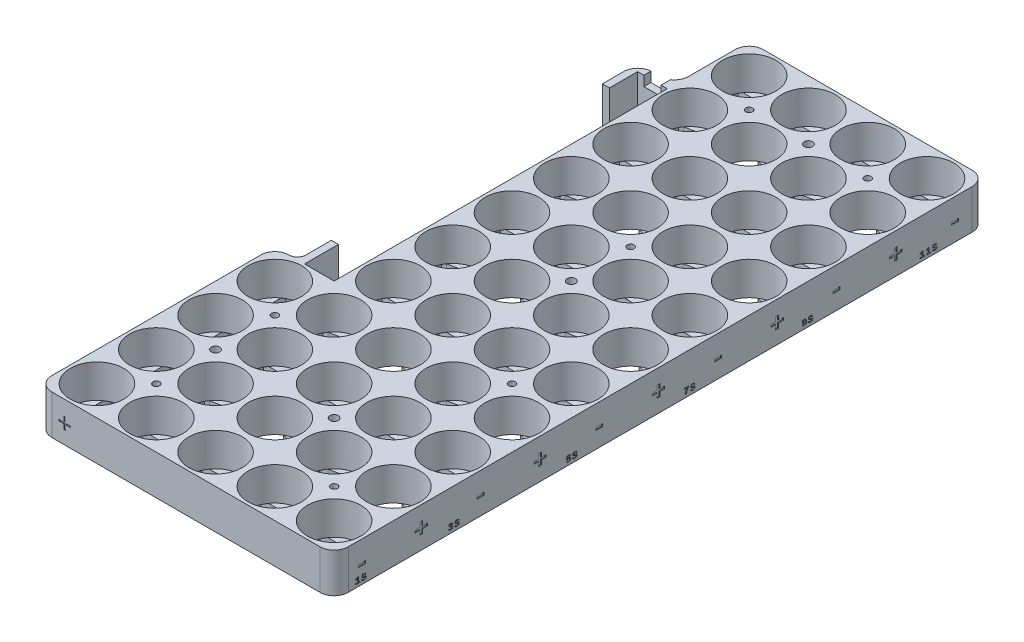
SolidWorks part; units mm, degrees
ref_plane "Plan de face" through (0, 0, 0) normal (0, 0, 1) x (1, 0, 0)
ref_plane "Plan de dessus" through (0, 0, 0) normal (0, 1, 0) x (1, 0, 0)
ref_plane "Plan de droite" through (0, 0, 0) normal (1, 0, 0) x (0, 0, -1)
ref_plane "Plan1" [suppressed] through (0, -1, 0) normal (0, 1, 0) x (1, 0, 0)
sketch "Esquisse1" plane through (0, 0, 0) normal (0, 1, 0) x (1, 0, 0)
  line L0 (-63, 0) -> (63, 0) construction
  line L1 (63, 0) -> (63, 84) construction
  line L2 (63, 84) -> (42, 84) construction
  line L3 (42, 84) -> (42, 231)
  line L4 (42, 231) -> (-42, 231)
  line L5 (-42, 231) -> (-42, 84)
  line L6 (-42, 84) -> (-63, 84)
  line L7 (-63, 84) -> (-63, 0)
  line L8 (42, 84) -> (42, 0)
  line L9 (42, 0) -> (-63, 0)
extrude "Boss.-Extru.1" add sketch "Esquisse1" along normal blind 14
sketch "Esquisse2" plane through (0, 14, 0) normal (0, 1, 0) x (1, 0, 0)
  line L0 (-63, 84) -> (-63, 0) construction
  line L2 (-63, 0) -> (42, 0) construction
  circle A0 centre (-52.5, 10.5) radius 9.475
extrude "Enlèv. mat.-Extru.1" cut sketch "Esquisse2" against normal offset from surface (11.8 mm away) 2.2
pattern_linear "Répétition linéaire1" count 11 spacing 21 along (0, 0, -1) count 6 spacing 21 along (1, 0, 0) of "Enlèv. mat.-Extru.1"
sketch "Esquisse3" plane through (0, 14, 0) normal (0, 1, 0) x (1, 0, 0)
  line L2 (-52.5, 52.5) -> (-31.5, 31.5) construction
  circle A0 centre (-42, 42) radius 1.5
  circle A1 centre (-52.5, 52.5) radius 9.475 construction
  circle A3 centre (-31.5, 31.5) radius 9.475 construction
  dimension "D1" = 3
extrude "Enlèv. mat.-Extru.2" cut sketch "Esquisse3" against normal through all
chamfer "Chanfrein1" distance 2.6 angle 45 1 edges at (-42, 0, -40.5)
pattern_linear "Répétition linéaire2" count 2 spacing 42 along (1, 0, 0) of "Enlèv. mat.-Extru.2", "Chanfrein1"
pattern_linear "Répétition linéaire3" count 3 spacing 84 along (0, 0, -1) of "Répétition linéaire2"
sketch "Esquisse6" plane through (0, 0, 0) normal (0, -1, 0) x (1, 0, 0)
  line L0 (-41, -5) -> (-41, -16)
  line L1 (-41, -5) -> (41, -5)
  line L2 (-41, -16) -> (41, -16)
  line L3 (41, -5) -> (41, -16)
  line L4 (42, 0) -> (42, -231) construction
  line L5 (0, 0) -> (0, -5) construction
  line L6 (-63, 0) -> (42, 0) construction
  point P9 (-41, -10.5)
extrude "Enlèv. mat.-Extru.5" cut sketch "Esquisse6" against normal up to surface (2.2 mm away) contours L1 L3 L2 L0
pattern_linear "Répétition linéaire6" count 11 spacing 21 along (0, 0, -1) of "Enlèv. mat.-Extru.5"
sketch "Esquisse7" plane through (0, 0, 0) normal (0, -1, 0) x (1, 0, 0)
  line L0 (-58, -1) -> (-58, -83)
  line L1 (-58, -1) -> (-47, -1)
  line L2 (-58, -83) -> (-47, -83)
  line L3 (-47, -1) -> (-47, -83)
  line L4 (-41, -16) -> (41, -16) construction
  line L5 (-41, -5) -> (-41, -16) construction
  line L6 (-63, -84) -> (-63, 0) construction
  line L7 (-42, -84) -> (-63, -84) construction
  point P8 (-52.5, -83)
extrude "Enlèv. mat.-Extru.6" cut sketch "Esquisse7" against normal up to surface (2.2 mm away)
fillet "Congé1" radius 5 5 edges at (42, 7, -231) (-42, 7, -231) (-63, 7, -84) (-63, 7, 0) (42, 7, 0)
sketch "Esquisse8" plane through (0, 0, 0) normal (0, -1, 0) x (1, 0, 0)
  line L0 (-39.2153, -205) -> (-26.5, -207.5483)
  line L1 (-26.5, -207.5483) -> (-26.5, -212.4517)
  line L2 (-26.5, -212.4517) -> (-39.2153, -215)
  line L3 (-39.2153, -215) -> (-2.7847, -215)
  line L4 (-2.7847, -215) -> (-15.5, -212.4517)
  line L5 (-15.5, -212.4517) -> (-15.5, -207.5483)
  line L6 (-15.5, -207.5483) -> (-2.7847, -205)
  line L7 (-2.7847, -205) -> (-39.2153, -205)
  line L8 (-26.5, -210) -> (-15.5, -210) construction
  line L9 (-41, -194) -> (-41, -205) construction
  arc A1 (-23.7847, -226) -> (-23.7847, -215) centre (-31.5, -220.5) ccw construction
  arc A2 (-18.2153, -215) -> (-18.2153, -226) centre (-10.5, -220.5) ccw construction
  arc A4 (-23.7847, -205) -> (-23.7847, -194) centre (-31.5, -199.5) ccw construction
extrude "Enlèv. mat.-Extru.7" cut sketch "Esquisse8" against normal up to surface (2.2 mm away)
pattern_linear "Répétition linéaire7" count 5 spacing 42 along (0, 0, 1) count 2 spacing 42 along (1, 0, 0) of "Enlèv. mat.-Extru.7"
sketch "Esquisse9" plane through (0, 0, 0) normal (0, -1, 0) x (1, 0, 0)
  line L0 (-41, -5) -> (-41, -16)
  line L1 (-41, -5) -> (-44.7847, -5)
  line L2 (-41, -16) -> (-44.7847, -16)
  line L4 (-47, -23.7847) -> (-47, -18.2153) construction
  line L5 (-47, -83) -> (-47, -1) construction
  line L6 (-47, -2.7847) -> (-47, -18.2153)
  arc A0 (-47, -2.7847) -> (-44.7847, -5) centre (-52.5, -10.5) cw
  arc A1 (-47, -2.7847) -> (-58, -2.7847) centre (-52.5, -10.5) ccw construction
  arc A2 (-44.7847, -16) -> (-47, -18.2153) centre (-52.5, -10.5) cw
extrude "Enlèv. mat.-Extru.8" cut sketch "Esquisse9" against normal up to surface (2.2 mm away)
sketch "Esquisse10" [suppressed] plane through (0, 15, 0) normal (0, 1, 0) x (1, 0, 0)
  line L0 (42, 17.025) -> (42, 231)
  line L1 (42, 5) -> (42, 226) construction
  line L2 (42, 231) -> (-63, 231)
  line L3 (-63, 231) -> (-63, 0)
  line L4 (-63, 0) -> (3.975, 0)
  line L5 (-58, 0) -> (37, 0) construction
  line L6 (-1.025, 5) -> (-1.025, 17.025)
  line L7 (3.975, 22.025) -> (37, 22.025)
  line L9 (-63, 79) -> (-63, 5) construction
  line L10 (37, 231) -> (-37, 231) construction
  arc A0 (3.975, 0) -> (-1.025, 5) centre (3.975, 5) cw
  arc A1 (-1.025, 17.025) -> (3.975, 22.025) centre (3.975, 17.025) cw
  arc A2 (37, 22.025) -> (42, 17.025) centre (37, 17.025) cw
  arc A4 (37, 0) -> (42, 5) centre (37, 5) ccw construction
  arc A5 (3.1668, 25.5) -> (17.8332, 25.5) centre (10.5, 31.5) ccw construction
  circle A6 centre (-10.5, 10.5) radius 9.475 construction
  point P25 (-1.025, 10.5)
  point P31 (10.5, 22.025)
extrude "Enlèv. mat.-Extru.9" [suppressed] cut sketch "Esquisse10" against normal through all
sketch "Esquisse11" plane through (42, 0, 0) normal (1, 0, 0) x (0, 0, -1)
  line L0 (7.2951, 4.2041) -> (226, 4.2041) construction
  line L6 (226, 0) -> (226, 14) construction
  text T0 "- + - + - + - + - + -" font "Liberation Mono" height 5.26
extrude "TEXTE A" cut sketch "Esquisse11" against normal blind 0.35
sketch "Esquisse12" plane through (0, 0, 0) normal (0, 0, 1) x (1, 0, 0)
  line L0 (-58, 3.665) -> (-48.784, 3.665) construction
  line L1 (-58, 14) -> (-58, 0) construction
  text T0 "+" font "Century Gothic" height in points 23
extrude "TEXTE A x4" cut sketch "Esquisse12" against normal blind 0.2
sketch "Esquisse13" plane through (42, 0, 0) normal (1, 0, 0) x (0, 0, -1)
  line L0 (7.4084, 1.0445) -> (226, 1.0445) construction
  line L1 (226, 0) -> (226, 14) construction
  text T0 "1S             3S                 5S                 7S                 9S                 11S" font "Liberation Mono" height 2
extrude "Enlèv. mat.-Extru.10" cut sketch "Esquisse13" against normal blind 0.35
sketch "Esquisse14" [suppressed] plane through (0, 0, 0) normal (0, -1, 0) x (1, 0, 0)
  line L0 (0, -231) -> (0, -189)
  line L2 (0, -189) -> (42, -189)
  line L3 (42, -5) -> (42, -226) construction
  line L4 (42, -189) -> (42, 33.4331)
  line L5 (42, 33.4331) -> (-152.2459, 33.4331)
  line L6 (-152.2459, 33.4331) -> (-152.2459, -231)
  line L7 (-152.2459, -231) -> (0, -231)
  line L8 (37, -231) -> (-37, -231) construction
  line L9 (21, -184) -> (21, -194) construction
  line L10 (18.2153, -184) -> (23.7847, -184) construction
  line L11 (18.2153, -194) -> (23.7847, -194) construction
  point P2 (21, -189)
extrude "Enlèv. mat.-Extru.11" [suppressed] cut sketch "Esquisse14" against normal through all
fillet "Congé2" [suppressed] radius 6
sketch "Esquisse15" [suppressed] plane through (0, 0, 0) normal (0, -1, 0) x (1, 0, 0)
  line L0 (0, -205.9) -> (0, -214.1)
  arc A0 (0, -214.1) -> (0, -205.9) centre (0, -210) ccw construction
  arc A1 (0, -214.1) -> (0, -205.9) centre (0, -210) ccw
extrude "Boss.-Extru.2" [suppressed] add sketch "Esquisse15" against normal up to surface (12 mm away)
sketch "Esquisse16" plane through (0, 0, 0) normal (0, -1, 0) x (1, 0, 0)
  line L0 (21, -26) -> (21, -16) construction
  line L1 (18.2153, -26) -> (23.7847, -26) construction
  line L2 (18.2153, -16) -> (23.7847, -16) construction
  line L3 (-52.5, -52.5) -> (-31.5, -73.5) construction
  line L4 (-42, -21) -> (-42, -63) construction
  line L5 (0, -142) -> (0, -152) construction
  line L6 (21, -21) -> (-42, -21) construction
  line L7 (-2.7847, -142) -> (2.7847, -142) construction
  line L8 (-2.7847, -152) -> (2.7847, -152) construction
  line L9 (-21, -210) -> (21, -210) construction
  line L10 (-10.5, -199.5) -> (-31.5, -220.5) construction
  line L11 (10.5, -73.5) -> (31.5, -94.5) construction
  circle A0 centre (-42, -21) radius 1.2
  circle A1 centre (-42, -63) radius 1.2
  circle A2 centre (21, -21) radius 1.2
  circle A3 centre (0, -147) radius 1.2
  circle A4 centre (-21, -210) radius 1.2
  circle A5 centre (21, -210) radius 1.2
  circle A6 centre (21, -84) radius 1.2
  circle A8 centre (0, -210) radius 1.5 construction
  point P30 (0, -210)
  dimension "D1" = 2.4
extrude "Enlèv. mat.-Extru.12" cut sketch "Esquisse16" against normal through all
chamfer "Chanfrein2" [suppressed] distance 3 angle 45
sketch "Esquisse17" plane through (0, 0, 0) normal (0, -1, 0) x (1, 0, 0)
  line L1 (-42, -84) -> (-55, -84)
  line L2 (-42, -84) -> (-42, -96)
  line L3 (-42, -96) -> (-55, -96)
  line L4 (-55, -84) -> (-55, -96)
  dimension "D1" = 13
  dimension "D2" = 12
extrude "Boss.-Extru.3" add sketch "Esquisse17" against normal up to surface (14 mm away)
sketch "Esquisse19" plane through (0, 0, -96) normal (0, 0, -1) x (-1, 0, 0)
  line L0 (39.2153, 2.2) -> (23.7847, 2.2) construction
  line L1 (42, 14) -> (52.5, 14)
  line L2 (42, 14) -> (42, 1.4)
  line L3 (42, 1.4) -> (52.5, 1.4)
  line L4 (52.5, 14) -> (52.5, 1.4)
  line L5 (39.2153, 2.2) -> (23.7847, 2.2) construction
  dimension "D1" = 10.5
  dimension "D2" = 0.8
extrude "Enlèv. mat.-Extru.13" cut sketch "Esquisse19" against normal up to surface (12 mm away)
fillet "Congé3" radius 3 1 edges at (-55, 7, -84)
sketch "Esquisse20" plane through (0, 14, 0) normal (0, 1, 0) x (1, 0, 0)
  line L0 (-42, 226) -> (-42, 84) construction
  line L1 (-42, 204.5) -> (-55, 204.5)
  line L2 (-42, 204.5) -> (-42, 202)
  line L3 (-52.5, 192) -> (-55, 192)
  line L4 (-55, 204.5) -> (-55, 192)
  line L6 (-42, 202) -> (-55, 202) construction
  line L7 (-48.5, 202) -> (-48.5, 204.5) construction
  line L8 (-55, 96) -> (-52.5, 96) construction
  line L9 (-52.5, 84) -> (-42, 84) construction
  line L10 (-55, 87) -> (-55, 96) construction
  line L11 (-52.5, 192) -> (-52.5, 202)
  line L12 (-52.5, 202) -> (-42, 202)
  line L13 (-52.5, 84) -> (-52.5, 96) construction
  dimension "D1" = 118
  dimension "D2" = 10
extrude "Boss.-Extru.4" add sketch "Esquisse20" against normal up to surface (14 mm away)
sketch "Esquisse21" plane through (0, 0, 0) normal (0, -1, 0) x (1, 0, 0)
  line L1 (-42, -202) -> (-52.5, -202)
  line L2 (-42, -202) -> (-42, -192)
  line L3 (-42, -192) -> (-52.5, -192)
  line L4 (-52.5, -202) -> (-52.5, -192)
extrude "Boss.-Extru.5" add sketch "Esquisse21" against normal up to surface (1.4 mm away)
fillet "Congé4" radius 5 2 edges at (-42, 7, -204.5) (-55, 7, -204.5)
sketch "Esquisse22" plane through (0, 0, -202) normal (0, 0, 1) x (1, 0, 0)
  line L0 (-52.5, 14) -> (-42, 14) construction
  line L1 (-50.3, 14) -> (-44.2, 14)
  line L2 (-50.3, 14) -> (-50.3, 10.5)
  line L3 (-50.3, 10.5) -> (-44.2, 10.5)
  line L4 (-44.2, 14) -> (-44.2, 10.5)
  line L5 (-42, 1.4) -> (-42, 14) construction
  dimension "D1" = 2.2
  dimension "D2" = 2.2
  dimension "D3" = 3.5
extrude "Enlèv. mat.-Extru.14" cut sketch "Esquisse22" against normal blind 10
sketch "Esquisse23" [suppressed] plane through (0, 0, 0) normal (0, -1, 0) x (1, 0, 0)
  line L0 (-42, -192) -> (-42, -96) construction
  line L1 (-110.4959, 30.5264) -> (75.944, 30.5264)
  line L2 (-110.4959, 30.5264) -> (-110.4959, -142)
  line L3 (-42, -142) -> (42, -142)
  line L4 (75.944, 30.5264) -> (75.944, -142)
  line L5 (-41, -142) -> (41, -142) construction
  line L6 (-41, -194) -> (41, -194) construction
  line L7 (-42, -194) -> (42, -194)
  line L8 (-110.4959, -194) -> (-110.4959, -257.2093)
  line L9 (-110.4959, -257.2093) -> (75.944, -257.2093)
  line L10 (75.944, -194) -> (75.944, -257.2093)
  line L12 (-110.4959, -142) -> (-110.4959, -194)
  line L14 (-42, -142) -> (-42, -194)
  line L15 (42, -5) -> (42, -226) construction
  line L17 (42, -194) -> (42, -142)
  line L19 (75.944, -194) -> (75.944, -142)
extrude "Enlèv. mat.-Extru.15" [suppressed] cut sketch "Esquisse23" against normal through all
sketch "Esquisse24" [suppressed] plane through (0, 2.2, 0) normal (0, -1, 0) x (1, 0, 0)
  line L1 (-42, -142) -> (42, -142)
  line L2 (-42, -142) -> (-42, -194)
  line L3 (-42, -194) -> (42, -194)
  line L4 (42, -142) -> (42, -194)
extrude "Enlèv. mat.-Extru.16" [suppressed] cut sketch "Esquisse24" against normal through all
sketch "Esquisse25" [suppressed] plane through (0, 0, 0) normal (0, -1, 0) x (1, 0, 0)
  line L0 (-42, -194) -> (-42, -142) construction
  line L1 (-42, -165.5483) -> (42, -165.5483)
  line L2 (-42, -165.5483) -> (-42, -170.4517)
  line L3 (-42, -170.4517) -> (42, -170.4517)
  line L4 (42, -165.5483) -> (42, -170.4517)
  line L5 (42, -142) -> (42, -194) construction
extrude "Boss.-Extru.6" [suppressed] add sketch "Esquisse25" along normal blind 2.5
fillet "Congé5" [suppressed] radius 10
equation "\"L\"=21"
equation "\"D2@Esquisse1\"=4*\"L\""
equation "\"D4@Esquisse1\"=4*\"L\""
equation "\"D3@Esquisse1\"=11*\"L\""
equation "\"D1@Esquisse1\"=1*\"L\""
equation "\"D2@Esquisse2\"=1/2*\"L\""
equation "\"D1@Esquisse2\"=1/2*\"L\""
equation "\"D3@Répétition linéaire1\"=\"L\""
equation "\"D4@Répétition linéaire1\"=\"L\""
equation "\"D3@Répétition linéaire6\"=\"L\""
equation "\"D3@Répétition linéaire7\"=2*\"L\""
equation "\"D3@Esquisse6\"=\"L\"/2"
equation "\"D1@Esquisse7\"=\"L\"/2"
equation "\"D3@Répétition linéaire2\"=\"L\"*2"
equation "\"D4@Répétition linéaire7\"=2*\"L\""
equation "\"D3@Répétition linéaire3\"=\"L\"*4"
